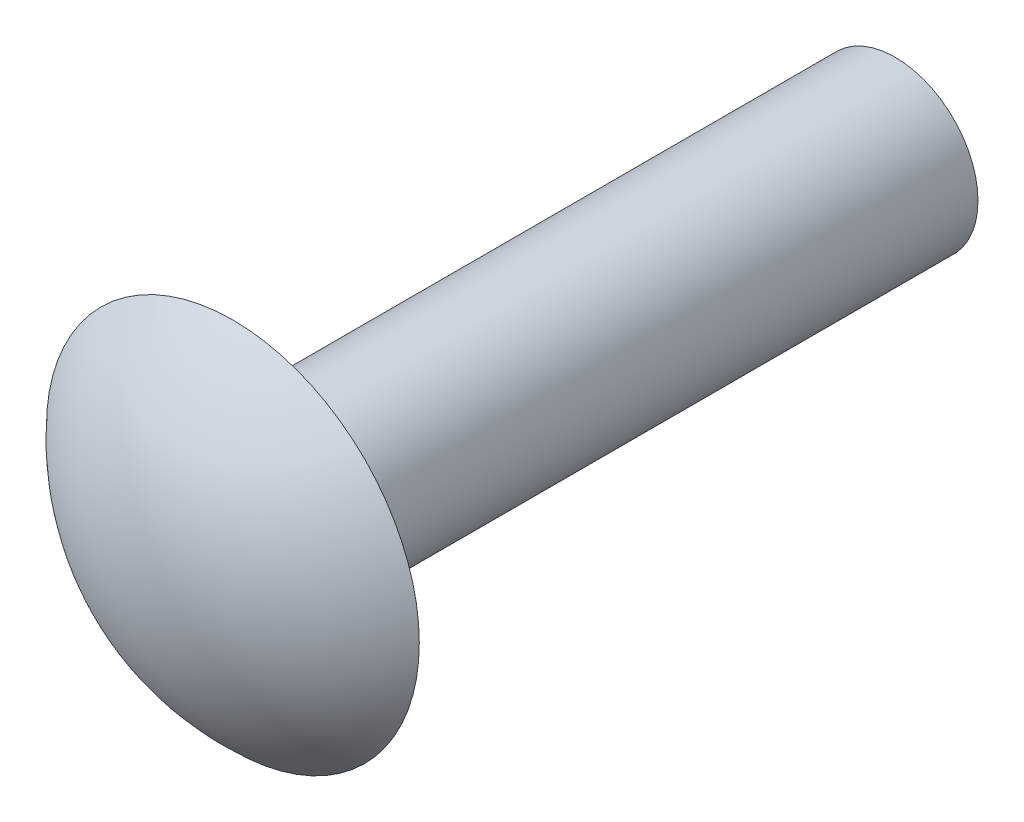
SolidWorks part; units mm, degrees
ref_plane "Front Plane" through (0, 0, 0) normal (0, 0, 1) x (1, 0, 0)
ref_plane "Top Plane" through (0, 0, 0) normal (0, 1, 0) x (1, 0, 0)
ref_plane "Right Plane" through (0, 0, 0) normal (1, 0, 0) x (0, 0, -1)
other "Configuration Table"
sketch "BaseBodySke" plane through (0, 0, 0) normal (0, 1, 0) x (1, 0, 0)
  line L0 (-7.1501, 3.175) -> (-3.175, 3.175)
  line L1 (0, 0) -> (0, 54.1082) construction
  line L2 (0, 0) -> (0, 28.575)
  line L3 (0, 28.575) -> (-3.175, 28.575)
  line L4 (-3.175, 3.175) -> (-3.175, 28.575)
  line L5 (-7.1501, 28.575) -> (-7.1501, 3.175) construction
  line L6 (-7.1501, 0) -> (-7.1501, 3.175) construction
  arc A0 (-7.1501, 3.175) -> (0, 0) centre (0, 9.6385) ccw
  dimension "Diameter" = 6.35
  dimension "Head_Diameter" = 14.3002
  dimension "Length" = 25.4
  dimension "Head_Depth" = 3.175
revolve "BaseBody" add sketch "BaseBodySke" angle 360 about L1
